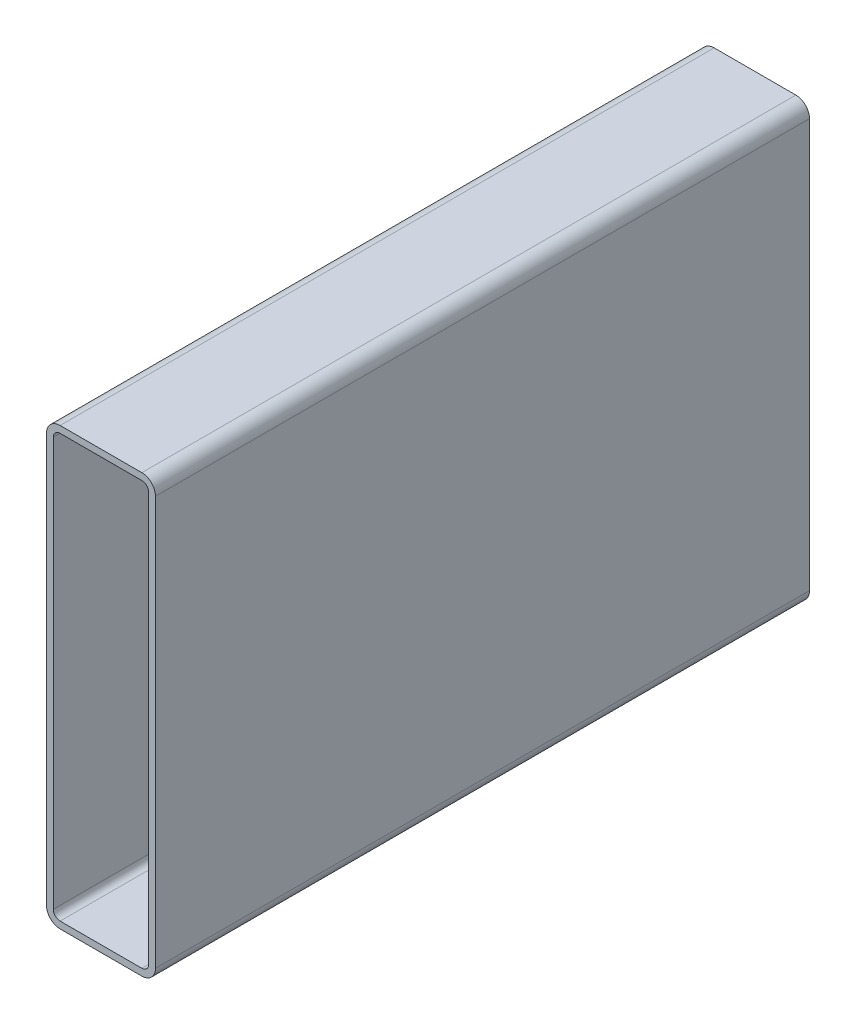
SolidWorks part; units mm, degrees
ref_plane "Front Plane" through (0, 0, 0) normal (0, 0, 1) x (1, 0, 0)
ref_plane "Top Plane" through (0, 0, 0) normal (0, 1, 0) x (1, 0, 0)
ref_plane "Right Plane" through (0, 0, 0) normal (1, 0, 0) x (0, 0, -1)
sketch "Sketch1" plane through (0, 0, 0) normal (0, 0, 1) x (1, 0, 0)
  line B0 (6.35, 203.2) -> (44.45, 203.2)
  arc B1 (50.8, 196.85) -> (44.45, 203.2) centre (44.45, 196.85) ccw
  line B2 (50.8, 196.85) -> (50.8, 6.35)
  arc B3 (44.45, 0) -> (50.8, 6.35) centre (44.45, 6.35) ccw
  line B4 (44.45, 0) -> (6.35, 0)
  arc B5 (0, 6.35) -> (6.35, 0) centre (6.35, 6.35) ccw
  line B6 (0, 6.35) -> (0, 196.85)
  arc B7 (6.35, 203.2) -> (0, 196.85) centre (6.35, 196.85) ccw
  line B8 (6.35, 200.025) -> (44.45, 200.025)
  arc B9 (47.625, 196.85) -> (44.45, 200.025) centre (44.45, 196.85) ccw
  line B10 (47.625, 196.85) -> (47.625, 6.35)
  arc B11 (44.45, 3.175) -> (47.625, 6.35) centre (44.45, 6.35) ccw
  line B12 (44.45, 3.175) -> (6.35, 3.175)
  arc B13 (3.175, 6.35) -> (6.35, 3.175) centre (6.35, 6.35) ccw
  line B14 (3.175, 6.35) -> (3.175, 196.85)
  arc B15 (6.35, 200.025) -> (3.175, 196.85) centre (6.35, 196.85) ccw
sketch_block_instance "HSS8x2x0.125-1"
sketch_block "HSS8x2x0.125"
extrude "Boss-Extrude1" add sketch "Sketch1" along normal blind 304.8
